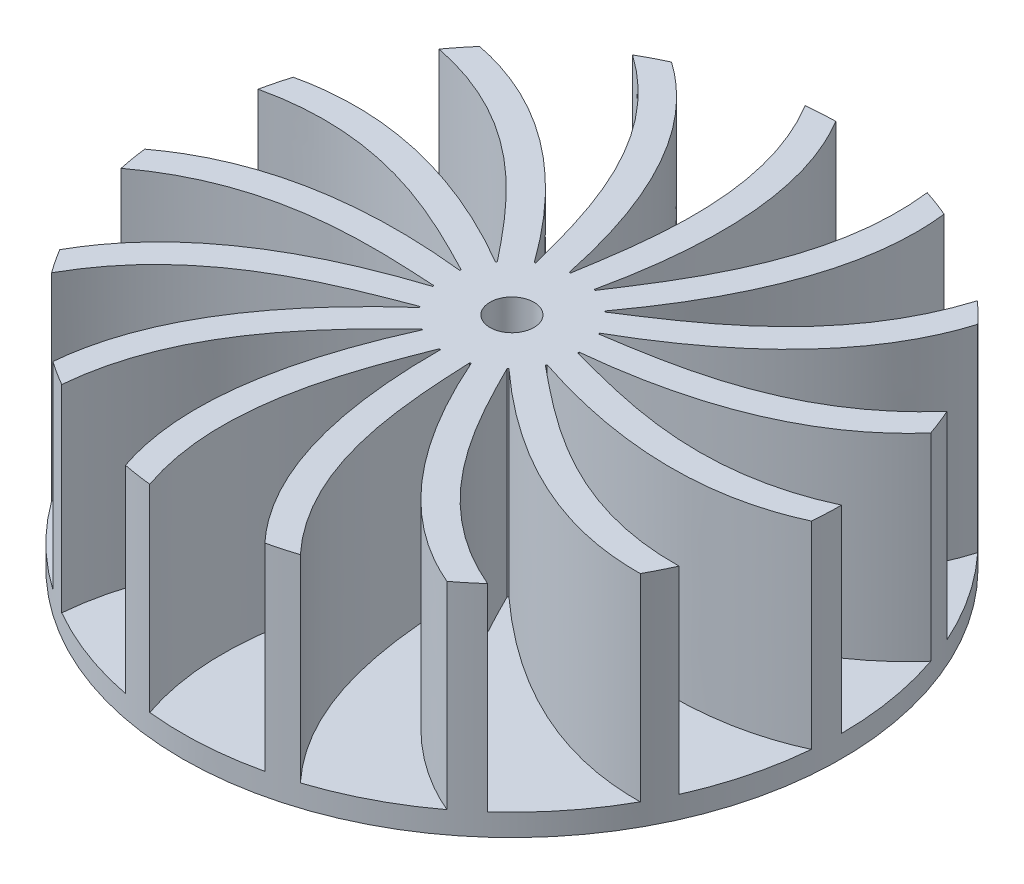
SolidWorks part; units mm, degrees
ref_plane "Front Plane" through (0, 0, 0) normal (0, 0, 1) x (1, 0, 0)
ref_plane "Top Plane" through (0, 0, 0) normal (0, 1, 0) x (1, 0, 0)
ref_plane "Right Plane" through (0, 0, 0) normal (1, 0, 0) x (0, 0, -1)
sketch "Sketch1" plane through (0, 0, 0) normal (0, 1, 0) x (1, 0, 0)
  circle A0 centre (0, 0) radius 15
  dimension "D1" = 30
extrude "Boss-Extrude1" add sketch "Sketch1" along normal blind 1
sketch "Sketch2" plane through (0, 1, 0) normal (0, 1, 0) x (1, 0, 0)
  circle A0 centre (0, 0) radius 3
  circle A1 centre (0, 0) radius 1.5
  dimension "D1" = 6
  dimension "D2" = 3
extrude "Boss-Extrude2" add sketch "Sketch2" along normal blind 9 contours A0
sketch "Sketch4" plane through (0, 1, 0) normal (0, 1, 0) x (1, 0, 0)
  line L0 (-5.5, 0) -> (5.5, 0) construction
  line L1 (18.6058, 1.6753) -> (11.3942, -1.6753) construction
  line L2 (18.8598, 0.5081) -> (11.061, -3.1153) construction
  circle A0 centre (0, 0) radius 3 construction
  circle A1 centre (0, 0) radius 3 construction
  circle A2 centre (0, 0) radius 15 construction
  arc A3 (15, 0) -> (14.9425, -1.3119) centre (0, 0) cw
  arc A4 (2.7645, -1.165) -> (3, 0) centre (0, 0) ccw
  arc A5 (2.0517, -2.1888) -> (2.7406, -1.2202) centre (0, 0) ccw
  arc A6 (13.7032, -6.101) -> (13.1171, -7.2762) centre (0, 0) cw
  arc A7 (0.984, -2.834) -> (2.0074, -2.2294) centre (0, 0) ccw
  arc A8 (10.037, -11.1472) -> (9.0235, -11.9823) centre (0, 0) cw
  arc A9 (-0.2537, -2.9893) -> (0.9271, -2.8532) centre (0, 0) ccw
  arc A10 (4.6353, -14.2658) -> (3.3698, -14.6166) centre (0, 0) cw
  arc A11 (-1.4476, -2.6276) -> (-0.3136, -2.9836) centre (0, 0) ccw
  arc A12 (-1.5679, -14.9178) -> (-2.8667, -14.7235) centre (0, 0) cw
  arc A13 (-2.3912, -1.8116) -> (-1.5, -2.5981) centre (0, 0) ccw
  arc A14 (-7.5, -12.9904) -> (-8.6074, -12.2846) centre (0, 0) cw
  arc A15 (-2.9214, -0.6824) -> (-2.4271, -1.7634) centre (0, 0) ccw
  arc A16 (-12.1353, -8.8168) -> (-12.8599, -7.7216) centre (0, 0) cw
  arc A17 (-2.9464, 0.5648) -> (-2.9344, -0.6237) centre (0, 0) ccw
  arc A18 (-14.6722, -3.1187) -> (-14.8888, -1.8235) centre (0, 0) cw
  arc A19 (-2.4619, 1.7144) -> (-2.9344, 0.6237) centre (0, 0) ccw
  arc A20 (-14.6722, 3.1187) -> (-14.3432, 4.39) centre (0, 0) cw
  arc A21 (-1.5518, 2.5675) -> (-2.4271, 1.7634) centre (0, 0) ccw
  arc A22 (-12.1353, 8.8168) -> (-11.3176, 9.8444) centre (0, 0) cw
  arc A23 (-0.3733, 2.9767) -> (-1.5, 2.5981) centre (0, 0) ccw
  arc A24 (-7.5, 12.9904) -> (-6.3351, 13.5966) centre (0, 0) cw
  arc A25 (0.8697, 2.8712) -> (-0.3136, 2.9836) centre (0, 0) ccw
  arc A26 (-1.5679, 14.9178) -> (-0.2572, 14.9978) centre (0, 0) cw
  arc A27 (1.9623, 2.2692) -> (0.9271, 2.8532) centre (0, 0) ccw
  arc A28 (4.6353, 14.2658) -> (5.8652, 13.8058) centre (0, 0) cw
  arc A29 (2.7156, 1.2749) -> (2.0074, 2.2294) centre (0, 0) ccw
  arc A30 (10.037, 11.1472) -> (10.9734, 10.2266) centre (0, 0) cw
  arc A31 (2.9994, 0.0601) -> (2.7406, 1.2202) centre (0, 0) ccw
  arc A32 (13.7032, 6.101) -> (14.1843, 4.8792) centre (0, 0) cw
  spline S0 degree 3 poles (3, 0) (6.0429, -0.8283) (10.4927, -2.0942) (15, 0) knots 0 0 0 0 1 1 1 1
  spline S1 degree 2 poles (2.7645, -1.165) (10.0683, -3.5766) (14.9425, -1.3119) knots 0 0 0 1 1 1
  spline S2 degree 3 poles (2.7406, -1.2202) (5.1835, -3.2146) (8.7338, -6.1809) (13.7032, -6.101) knots 0 0 0 0 1 1 1 1
  spline S3 degree 2 poles (2.0517, -2.1888) (7.7431, -7.3625) (13.1171, -7.2762) knots 0 0 0 1 1 1
  spline S4 degree 3 poles (2.0074, -2.2294) (3.4279, -5.045) (5.4647, -9.1989) (10.037, -11.1472) knots 0 0 0 0 1 1 1 1
  spline S5 degree 2 poles (0.984, -2.834) (4.0791, -9.8754) (9.0235, -11.9823) knots 0 0 0 1 1 1
  spline S6 degree 3 poles (0.9271, -2.8532) (1.0796, -6.0031) (1.2508, -10.6263) (4.6353, -14.2658) knots 0 0 0 0 1 1 1 1
  spline S7 degree 2 poles (-0.2537, -2.9893) (-0.2903, -10.6807) (3.3698, -14.6166) knots 0 0 0 1 1 1
  spline S8 degree 3 poles (-0.3136, -2.9836) (-1.4554, -5.9232) (-3.1795, -10.2163) (-1.5679, -14.9178) knots 0 0 0 0 1 1 1 1
  spline S9 degree 2 poles (-1.4476, -2.6276) (-4.6094, -9.6393) (-2.8667, -14.7235) knots 0 0 0 1 1 1
  spline S10 degree 3 poles (-1.5, -2.5981) (-3.7388, -4.8191) (-7.06, -8.0399) (-7.5, -12.9904) knots 0 0 0 0 1 1 1 1
  spline S11 degree 2 poles (-2.3912, -1.8116) (-8.1316, -6.9311) (-8.6074, -12.2846) knots 0 0 0 1 1 1
  spline S12 degree 3 poles (-2.4271, -1.7634) (-5.3756, -2.8818) (-9.7197, -4.4732) (-12.1353, -8.8168) knots 0 0 0 0 1 1 1 1
  spline S13 degree 2 poles (-2.9214, -0.6824) (-10.2477, -3.0245) (-12.8599, -7.7216) knots 0 0 0 1 1 1
  spline S14 degree 3 poles (-2.9344, -0.6237) (-6.083, -0.4462) (-10.6988, -0.1332) (-14.6722, -3.1187) knots 0 0 0 0 1 1 1 1
  spline S15 degree 2 poles (-2.9464, 0.5648) (-10.5919, 1.4051) (-14.8888, -1.8235) knots 0 0 0 1 1 1
  spline S16 degree 3 poles (-2.9344, 0.6237) (-5.7386, 2.0666) (-9.828, 4.23) (-14.6722, 3.1187) knots 0 0 0 0 1 1 1 1
  spline S17 degree 2 poles (-2.4619, 1.7144) (-9.1046, 5.5917) (-14.3432, 4.39) knots 0 0 0 1 1 1
  spline S18 degree 3 poles (-2.4271, 1.7634) (-4.4019, 4.222) (-7.2579, 7.8617) (-12.1353, 8.8168) knots 0 0 0 0 1 1 1 1
  spline S19 degree 2 poles (-1.5518, 2.5675) (-6.0431, 8.8115) (-11.3176, 9.8444) knots 0 0 0 1 1 1
  spline S20 degree 3 poles (-1.5, 2.5981) (-2.3041, 5.6474) (-3.4328, 10.134) (-7.5, 12.9904) knots 0 0 0 0 1 1 1 1
  spline S21 degree 2 poles (-0.3733, 2.9767) (-1.9367, 10.5077) (-6.3351, 13.5966) knots 0 0 0 1 1 1
  spline S22 degree 3 poles (-0.3136, 2.9836) (0.1921, 6.0963) (0.9859, 10.6541) (-1.5679, 14.9178) knots 0 0 0 0 1 1 1 1
  spline S23 degree 2 poles (0.8697, 2.8712) (2.5046, 10.387) (-0.2572, 14.9978) knots 0 0 0 1 1 1
  spline S24 degree 3 poles (0.9271, 2.8532) (2.6551, 5.4911) (5.2341, 9.332) (4.6353, 14.2658) knots 0 0 0 0 1 1 1 1
  spline S25 degree 2 poles (1.9623, 2.2692) (6.5128, 8.4703) (5.8652, 13.8058) knots 0 0 0 1 1 1
  spline S26 degree 3 poles (2.0074, 2.2294) (4.659, 3.9365) (8.5773, 6.3963) (10.037, 11.1472) knots 0 0 0 0 1 1 1 1
  spline S27 degree 2 poles (2.7156, 1.2749) (9.3949, 5.089) (10.9734, 10.2266) knots 0 0 0 1 1 1
  spline S28 degree 3 poles (2.7406, 1.2202) (5.8573, 1.7011) (10.4373, 2.3547) (13.7032, 6.101) knots 0 0 0 0 1 1 1 1
  spline S29 degree 2 poles (2.9994, 0.0601) (10.6526, 0.8278) (14.1843, 4.8792) knots 0 0 0 1 1 1
  point P76 (0, 0)
  dimension "D1" = 15
extrude "Boss-Extrude3" add sketch "Sketch4" along normal blind 9
sketch "Sketch5" plane through (0, 0, 0) normal (0, -1, 0) x (1, 0, 0)
  circle A0 centre (0, 0) radius 1
  dimension "D1" = 2
extrude "Cut-Extrude1" cut sketch "Sketch5" against normal through all both and the other way through all
